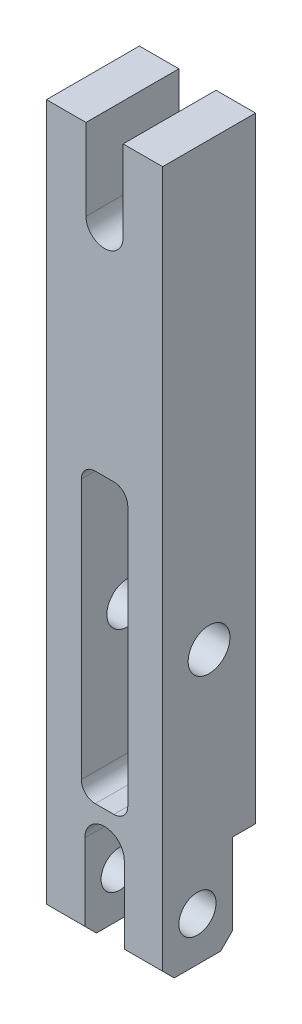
SolidWorks part; units mm, degrees
ref_plane "Plan de face" through (0, 0, 0) normal (0, 0, 1) x (1, 0, 0)
ref_plane "Plan de dessus" through (0, 0, 0) normal (0, 1, 0) x (1, 0, 0)
ref_plane "Plan de droite" through (0, 0, 0) normal (1, 0, 0) x (0, 0, -1)
sketch "Esquisse1" plane through (0, 0, 0) normal (0, 0, 1) x (1, 0, 0)
  line L0 (8, 190) -> (25, 190)
  line L1 (-25, 190) -> (-8, 190)
  line L2 (-25, 190) -> (-25, -115)
  line L3 (-25, -115) -> (-8.5, -115)
  line L4 (25, 190) -> (25, -115)
  line L5 (-4, 62) -> (4, 62)
  line L6 (-10, 56) -> (-10, -56)
  line L7 (-4, -62) -> (4, -62)
  line L8 (10, 56) -> (10, -56)
  line L9 (8.5, -115) -> (25, -115)
  line L10 (-8, 190) -> (-8, 155)
  line L12 (8, 190) -> (8, 155)
  line L13 (-8.5, -77) -> (-8.5, -115)
  line L15 (8.5, -77) -> (8.5, -115)
  arc A0 (-10, -56) -> (-4, -62) centre (-4, -56) ccw
  arc A1 (4, -62) -> (10, -56) centre (4, -56) ccw
  arc A2 (4, 62) -> (10, 56) centre (4, 56) cw
  arc A3 (-4, 62) -> (-10, 56) centre (-4, 56) ccw
  arc A4 (-8, 155) -> (8, 155) centre (0, 155) ccw
  arc A5 (8.5, -77) -> (-8.5, -77) centre (0, -77) ccw
  point P15 (10, 62)
  point P18 (-10, 62)
  dimension "D9" = 6
  dimension "D2" = 20
  dimension "D3" = 10
  dimension "D4" = 25
  dimension "D5" = 115
  dimension "D6" = 190
  dimension "D7" = 62
  dimension "D8" = 62
  dimension "D10" = 16
  dimension "D11" = 17
  dimension "D12" = 77
  dimension "D13" = 35
  dimension "D14" = 25
extrude "Volume" add sketch "Esquisse1" along normal blind 40
sketch "Esquisse6" plane through (-25, 0, 0) normal (-1, 0, 0) x (0, 0, 1)
  line L0 (0, 190) -> (0, -115) construction
  line L1 (-20, -75) -> (10, -75)
  line L2 (-20, -75) -> (-20, -135)
  line L3 (-20, -135) -> (10, -135)
  line L4 (10, -75) -> (10, -135)
  line L5 (40, -115) -> (0, -115) construction
  dimension "D1" = 10
  dimension "D2" = 30
  dimension "D3" = 20
  dimension "D4" = 40
extrude "Evidemment" cut sketch "Esquisse6" against normal through all
sketch "Esquisse2" plane through (-25, 0, 0) normal (-1, 0, 0) x (0, 0, 1)
  line L1 (40, 190) -> (40, -115) construction
  circle A0 centre (25, -96) radius 8
  dimension "D2" = 16
  dimension "D1" = 15
  dimension "D3" = 96
extrude "Alésage Ø16" cut sketch "Esquisse2" against normal through all
sketch "Esquisse5" plane through (-25, 0, 0) normal (-1, 0, 0) x (0, 0, 1)
  circle A0 centre (20, 0) radius 9
  dimension "D1" = 18
  dimension "D2" = 20
extrude "Alésage Ø18 palonnier" cut sketch "Esquisse5" against normal through all
chamfer "Chanfrein1" distance 5 angle 45 4 edges at (-16.75, -115, 10) (16.75, -115, 10) (-16.75, -115, 40) (16.75, -115, 40)
